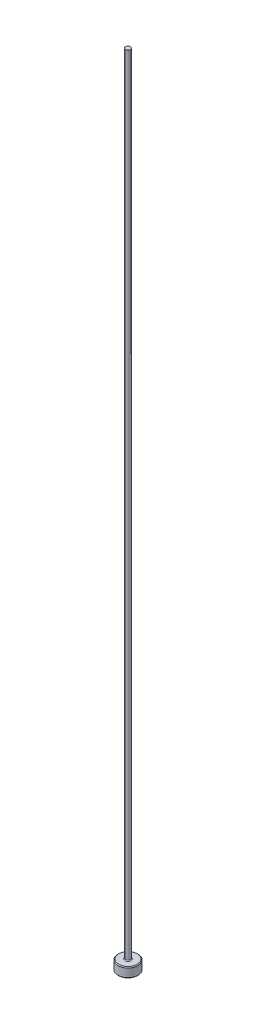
SolidWorks part; units mm, degrees
ref_plane "Front Plane" through (0, 0, 0) normal (0, 0, 1) x (1, 0, 0)
ref_plane "Top Plane" through (0, 0, 0) normal (0, 1, 0) x (1, 0, 0)
ref_plane "Right Plane" through (0, 0, 0) normal (1, 0, 0) x (0, 0, -1)
sketch "Sketch1" plane through (0, 0, 0) normal (0, 0, 1) x (1, 0, 0)
  line L0 (0, 259.9588) -> (0, -15.1925) construction
  line L1 (0, 0) -> (-3.175, 0)
  line L2 (-3.175, 0) -> (-3.175, 3.175)
  line L3 (-3.175, 3.175) -> (-0.7937, 3.175)
  line L4 (-0.7937, 3.175) -> (-0.7937, 254)
  line L5 (-0.7937, 254) -> (0, 254)
  line L6 (0, 254) -> (0, 0)
  dimension "L" = 254
  dimension "H" = 6.35
  dimension "T" = 3.175
  dimension "D" = 1.5875
revolve "Revolve1" add sketch "Sketch1" angle 360 about L0
chamfer "Chamfer1" distance 0.254 angle 45 2 edges at (0, 3.175, 3.175) (0, 0, 3.175)
fillet "Fillet1" radius 0.254 1 edges at (0, 3.175, 0.7937)
sketch "Pocket Sketch" plane through (0, 0, 0) normal (0, 0, 1) x (1, 0, 0)
  line L0 (-3.5719, 0) -> (-3.5719, 3.2004)
  line L1 (-3.5719, 3.2004) -> (-1.7542, 3.2004)
  line L2 (-0.9922, 3.9624) -> (-0.9922, 22.225)
  line L3 (-0.9922, 22.225) -> (0, 22.225)
  line L4 (0, 22.225) -> (0, 0)
  line L5 (0, 0) -> (-3.5719, 0)
  line L6 (0, 12.6104) -> (0, -2.4989) construction
  line L7 (-3.175, 2.921) -> (-3.175, 0.254) construction
  line L8 (2.921, 3.175) -> (-2.921, 3.175) construction
  line L9 (-0.7937, 254) -> (-0.7937, 3.429) construction
  line L10 (-1.7542, 3.2004) -> (-0.9922, 3.9624)
  point P3 (-0.9922, 3.2004)
  dimension "D1" = 7.1437
  dimension "D2" = 0.3969
  dimension "D3" = 0.0254
  dimension "D4" = 0.1984
  dimension "D5" = 1.9844
  dimension "D6" = 22.225
